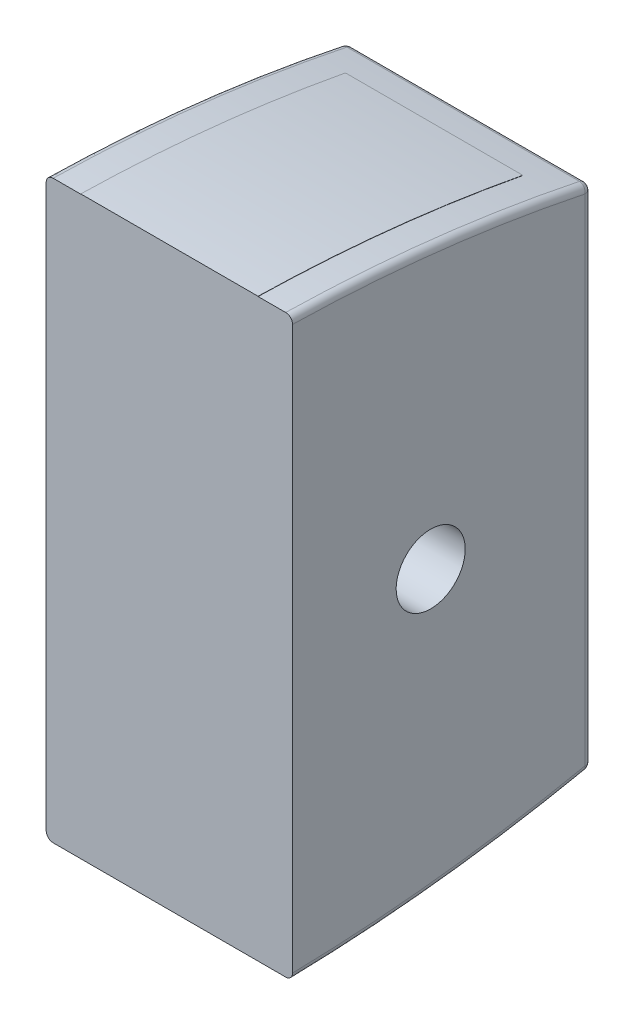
SolidWorks part; units mm, degrees
ref_plane "Front Plane" through (0, 0, 0) normal (0, 0, 1) x (1, 0, 0)
ref_plane "Top Plane" through (0, 0, 0) normal (0, 1, 0) x (1, 0, 0)
ref_plane "Right Plane" through (0, 0, 0) normal (1, 0, 0) x (0, 0, -1)
sketch "Sketch1" plane through (0, 0, 0) normal (0, 0, 1) x (1, 0, 0)
  line L0 (0, -55) -> (0, 55) construction
  line L1 (-5.35, 12.5) -> (5.35, 12.5)
  line L2 (-5.35, 12.5) -> (-5.35, -12.5)
  line L3 (-5.35, -12.5) -> (5.35, -12.5)
  line L4 (5.35, 12.5) -> (5.35, -12.5)
  line L5 (55, 0) -> (-55, 0) construction
  dimension "D1" = 10.7
  dimension "D2" = 5.35
  dimension "D3" = 25
  dimension "D4" = 12.5
extrude "Boss-Extrude1" add sketch "Sketch1" along normal blind 13
sketch "Sketch2" plane through (5.35, 0, 0) normal (1, 0, 0) x (0, 0, -1)
  line L0 (0, 5.885) -> (0, -5.885) construction
  line L1 (-13, 12.5) -> (0, 12.5) construction
  line L2 (-13, -12.5) -> (0, -12.5) construction
  line L3 (-13, 12.5) -> (-16.5256, 15.2261)
  line L4 (-16.5256, 15.2261) -> (5.8695, 15.2261)
  line L5 (5.8695, 15.2261) -> (0, 11)
  line L6 (0, -11) -> (6.0861, -15.706)
  line L7 (6.0861, -15.706) -> (-17.069, -15.3973)
  line L8 (-17.069, -15.3973) -> (-13, -12.5)
  arc A0 (-13, 12.5) -> (0, 11) centre (-14.4886, -57.4842) cw
  arc A1 (-13, -12.5) -> (0, -11) centre (-14.4886, 57.4842) ccw
  dimension "D3" = 70
  dimension "D4" = 70
  dimension "D1" = 1.5
  dimension "D2" = 1.5
extrude "Cut-Extrude1" cut sketch "Sketch2" against normal blind 13
sketch "Sketch3" plane through (0, 0, 0) normal (0, 1, 0) x (1, 0, 0)
  line L0 (-5.885, 0) -> (5.885, 0) construction
  line L1 (-3.85, -1.5) -> (3.85, -1.5)
  line L2 (-3.85, -1.5) -> (-3.85, -13.5)
  line L3 (-3.85, -13.5) -> (3.85, -13.5)
  line L4 (3.85, -1.5) -> (3.85, -13.5)
  line L5 (-5.35, 0) -> (-5.35, -13) construction
  line L6 (5.35, -13) -> (5.35, 0) construction
  dimension "D1" = 12
  dimension "D2" = 1.5
  dimension "D3" = 1.5
  dimension "D4" = 1.5
extrude "Boss-Extrude3" add sketch "Sketch3" along normal offset from surface (11.3103 mm away) 0.01
sketch "Sketch4" plane through (0, 0, 0) normal (0, 0, -1) x (-1, 0, 0)
  text T0 "on" font "Futura Bk BT" height in points 20
extrude "Cut-Extrude2" cut sketch "Sketch4" against normal blind 0.2
fillet "Fillet1" radius 0.1 23 edges at (-0.6415, -6.977, 0.2) (-0.9547, -5.2975, 0.2) (-1.268, -5.5564, 0.2) (-3.7046, -7.5127, 0.2) (-3.3914, -8.6565, 0.2) (-3.0781, -7.6639, 0.2) (-1.268, -7.7858, 0.2) (-0.9547, -8.6565, 0.2)
fillet "Fillet2" radius 0.3 8 edges at (0, 11, 0) (-5.35, 0, 0) (0, -11, 0) (5.35, 0, 0) (5.35, 12.0545, 6.4649) (-5.35, 12.0545, 6.4649) (-5.35, -12.0545, 6.4649) (5.35, -12.0545, 6.4649)
fillet "Fillet3" radius 0.05 2 edges at (3.85, 11.3053, 1.5) (-3.85, 11.3053, 1.5)
sketch "Sketch5" plane through (0, 0, 13) normal (0, 0, 1) x (1, 0, 0)
  line L1 (-10.7321, 22.9245) -> (16.1201, 22.9245)
  line L2 (-10.7321, 22.9245) -> (-10.7321, -10.7319)
  line L3 (-10.7321, -10.7319) -> (16.1201, -10.7319)
  line L4 (16.1201, 22.9245) -> (16.1201, -10.7319)
extrude "Cut-Extrude3" cut sketch "Sketch5" along normal blind 10
sketch "Sketch6" plane through (-5.35, 0, 0) normal (-1, 0, 0) x (0, 0, 1)
  line L0 (5.885, 0) -> (-5.885, 0) construction
  line L1 (0, -5.885) -> (0, 5.885) construction
  circle A0 centre (7, 0) radius 1.5
  dimension "D1" = 3
  dimension "D2" = 7
extrude "Cut-Extrude4" cut sketch "Sketch6" against normal blind 20
fillet "Fillet4" radius 0.1 4 edges
shell "Shell2" thickness 0.9
fillet "Fillet6" radius 0.2 5 edges
fillet "Fillet8" radius 0.2 14 edges at (-1.268, -7.7858, 0) (-3.0781, -7.6639, 0) (-3.3914, -8.6565, 0) (-3.7046, -7.5127, 0) (-1.268, -5.5564, 0) (-0.9547, -5.2975, 0) (-0.6415, -6.977, 0) (-0.9547, -8.6565, 0)
fillet "Fillet9" radius 0.2 2 edges at (-1.2382, -5.9103, 0.1712) (-1.3053, -5.6987, 0.0628)
